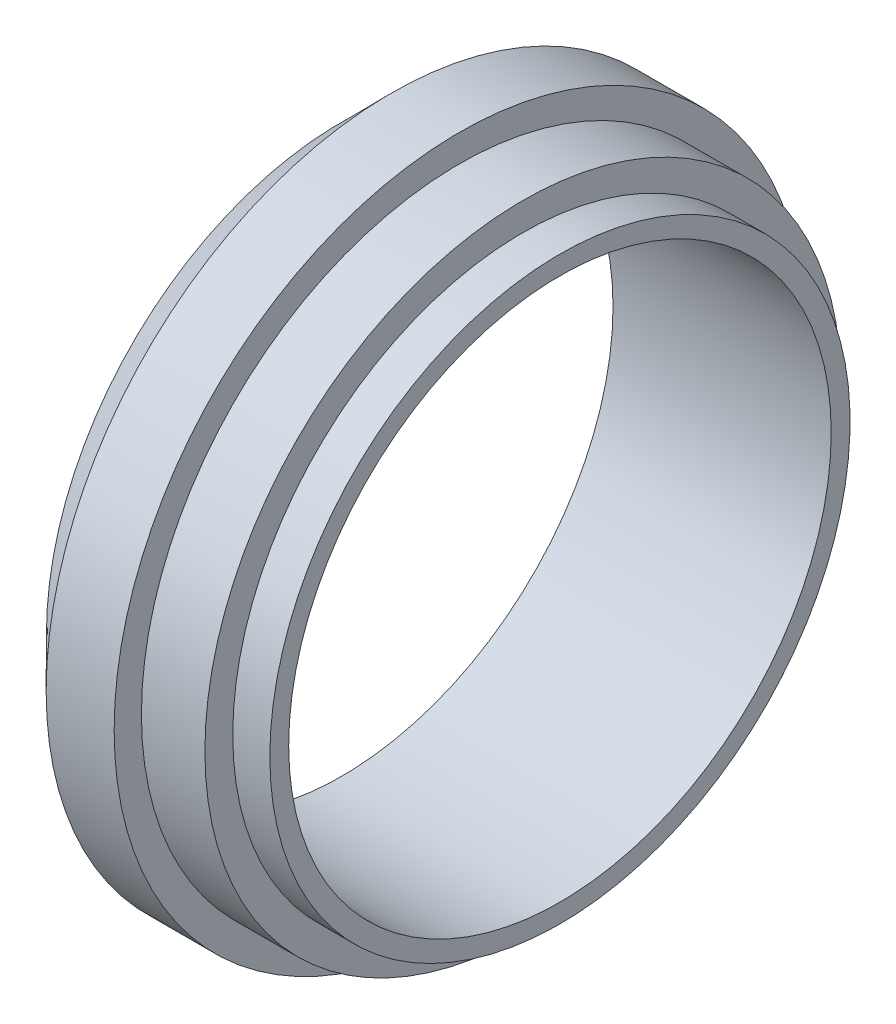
SolidWorks part; units mm, degrees
ref_plane "Front Plane" through (0, 0, 0) normal (0, 0, 1) x (1, 0, 0)
ref_plane "Top Plane" through (0, 0, 0) normal (0, 1, 0) x (1, 0, 0)
ref_plane "Right Plane" through (0, 0, 0) normal (1, 0, 0) x (0, 0, -1)
sketch "Sketch1" plane through (0, 0, 0) normal (0, 0, 1) x (1, 0, 0)
  line L0 (0, 0) -> (-3.2461, 0)
  line L1 (-3.2461, 0) -> (-3.2461, -2.4384)
  line L2 (-3.2461, -2.4384) -> (-8.8036, -2.4384)
  line L3 (-8.8036, -2.4384) -> (-8.8036, -4.826)
  line L4 (-8.8036, -4.826) -> (-14.7574, -4.826)
  line L5 (-14.7574, -4.826) -> (-19.1008, -0.4572)
  line L6 (-19.1008, -0.4572) -> (-19.1008, 25.4)
  line L7 (-19.1008, 25.4) -> (0, 25.4)
  line L8 (0, 25.4) -> (0, 0)
  dimension "D1" = 25.4
  dimension "D2" = 19.1008
  dimension "D3" = 5.5575
  dimension "D4" = 5.9538
  dimension "D5" = 4.3434
  dimension "D6" = 25.8572
  dimension "D7" = 30.226
  dimension "D8" = 27.8384
revolve "Revolve1" add sketch "Sketch1" angle 360 about L7
sketch "Sketch4" plane through (-19.1008, 0, 0) normal (-1, 0, 0) x (0, 0, 1)
  circle A0 centre (0, 25.4) radius 23.749
extrude "Cut-Extrude1" cut sketch "Sketch4" against normal blind 20.6375 contours A0
